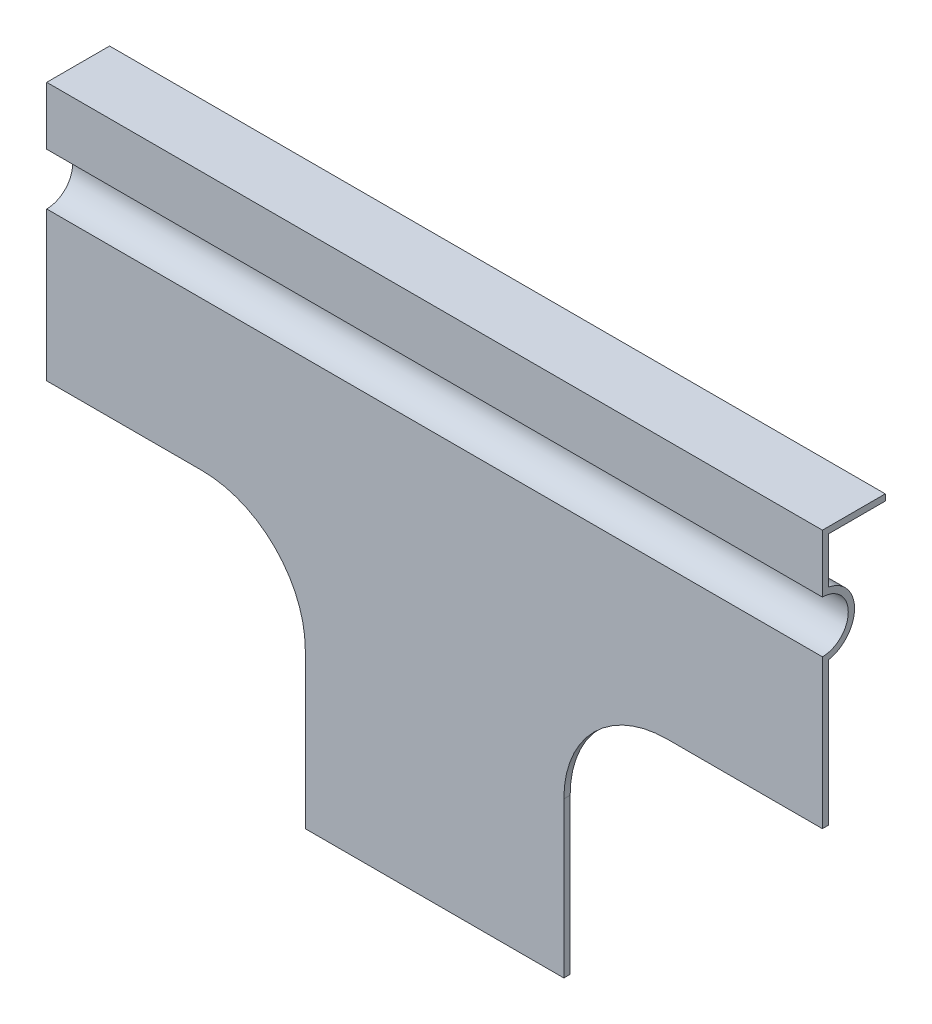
SolidWorks part; units mm, degrees
ref_plane "Front Plane" through (0, 0, 0) normal (0, 0, 1) x (1, 0, 0)
ref_plane "Top Plane" through (0, 0, 0) normal (0, 1, 0) x (1, 0, 0)
ref_plane "Right Plane" through (0, 0, 0) normal (1, 0, 0) x (0, 0, -1)
sketch "Sketch1" plane through (0, 0, 0) normal (1, 0, 0) x (0, 0, -1)
  line L0 (12.157, 42.6793) -> (0, 42.6793)
  line L1 (0, 42.6793) -> (0, 31.4653)
  line L2 (0, 21.4653) -> (0, -57.3207)
  line L3 (12.157, 41.4653) -> (1.214, 41.4653)
  line L4 (1.214, 41.4653) -> (1.214, 32.5596)
  line L5 (1.214, 20.371) -> (1.214, -57.3207)
  line L6 (12.157, 42.6793) -> (12.157, 41.4653)
  line L7 (0, -57.3207) -> (1.214, -57.3207)
  arc A0 (0, 31.4653) -> (0, 21.4653) centre (0, 26.4653) cw
  arc A1 (1.214, 32.5596) -> (1.214, 20.371) centre (0, 26.4653) cw
  dimension "D2" = 5
  dimension "D3" = 15
  dimension "D4" = 100
  dimension "D1" = 1.214
extrude "Extrude1" add sketch "Sketch1" along normal blind 150
sketch "Sketch2" plane through (0, 0, -1.214) normal (0, 0, -1) x (-1, 0, 0)
  line L0 (0, -7.3207) -> (-30, -7.3207)
  line L1 (-50, -27.3207) -> (-50, -57.3207)
  line L3 (-50, -57.3207) -> (-100, -57.3207)
  line L4 (-100, -57.3207) -> (-100, -27.3207)
  line L5 (-120, -7.3207) -> (-150, -7.3207)
  line L6 (-150, -7.3207) -> (-150, 42.6793) construction
  line L7 (0, -7.3207) -> (0, 42.6793) construction
  line L9 (-150, 42.6793) -> (0, 42.6793) construction
  arc A0 (-30, -7.3207) -> (-50, -27.3207) centre (-30, -27.3207) ccw
  arc A1 (-100, -27.3207) -> (-120, -7.3207) centre (-120, -27.3207) ccw
  dimension "D2" = 20
  dimension "D1" = 30
  dimension "D3" = 50
  dimension "D4" = 100
extrude "Extrude2" cut sketch "Sketch2" against normal through all and the other way through all flip side to cut
